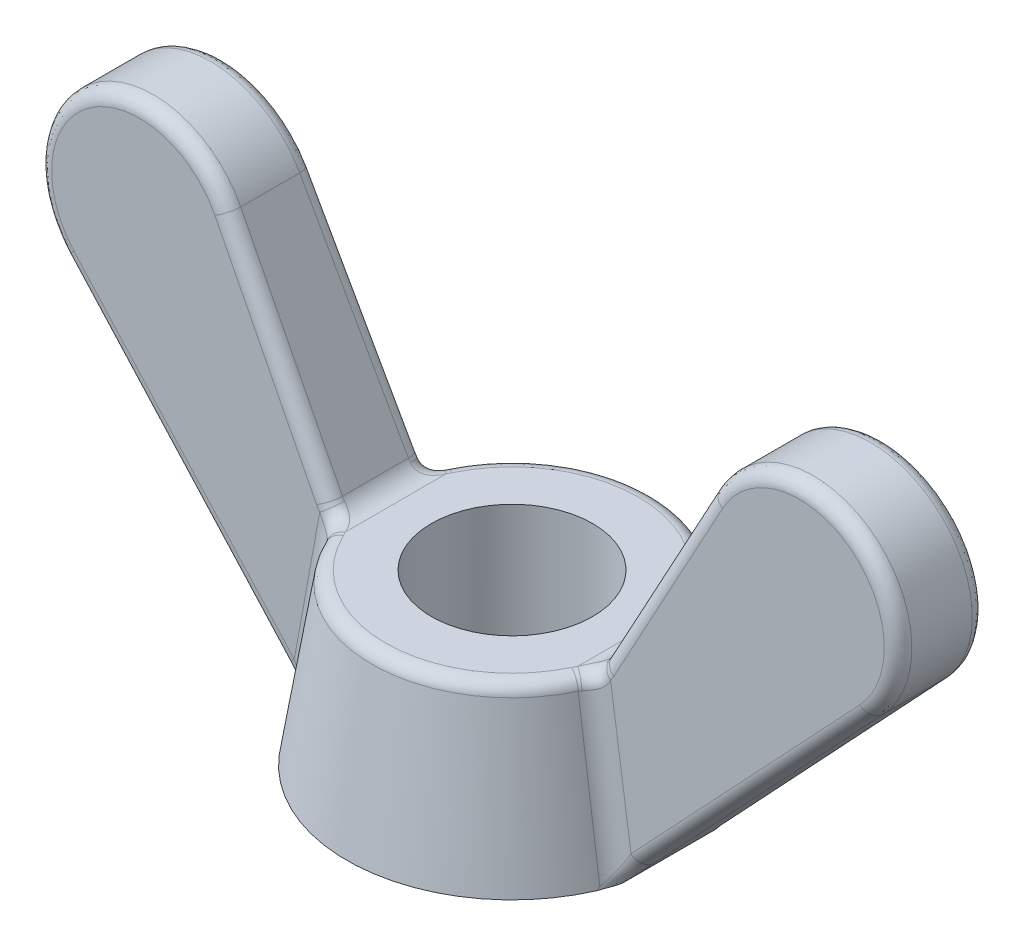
SolidWorks part; units mm, degrees
ref_plane "Front Plane" through (0, 0, 0) normal (0, 0, 1) x (1, 0, 0)
ref_plane "Top Plane" through (0, 0, 0) normal (0, 1, 0) x (1, 0, 0)
ref_plane "Right Plane" through (0, 0, 0) normal (1, 0, 0) x (0, 0, -1)
sketch "BaseNutSke" plane through (0, 0, 0) normal (0, 0, 1) x (1, 0, 0)
  line L0 (0, 0) -> (-21.5, 0)
  line L1 (-21.5, 0) -> (-18, 22)
  line L2 (-18, 22) -> (0, 22)
  line L3 (0, 22) -> (0, 0)
  line L4 (0, -38.5148) -> (0, 38.5148) construction
  dimension "Top_Width" = 36
  dimension "Bottom_Width" = 43
  dimension "Nut_Height" = 22
revolve "BaseNut" add sketch "BaseNutSke" angle 360 about L4
sketch "BaseWingSke" plane through (0, 0, 0) normal (1, 0, 0) x (0, 0, -1)
  line L0 (0, 0) -> (0, 62.8635) construction
  line L1 (-5.5, 56) -> (-6.5, 0)
  line L2 (-5.5, 56) -> (5.5, 56)
  line L3 (5.5, 56) -> (6.5, 0)
  line L4 (6.5, 0) -> (-6.5, 0)
  point P8 (0, 56)
  dimension "TopWing_Width" = 11
  dimension "BottomWing_Width" = 13
  dimension "Height" = 56
extrude "BaseWing" add sketch "BaseWingSke" along normal mid plane 112
sketch "CutWingSke" plane through (0, 0, 0) normal (0, 0, 1) x (1, 0, 0)
  line L0 (0, 0) -> (0, 84.5075) construction
  line L1 (-20.4939, 0) -> (-52.4668, 34.043)
  line L2 (-16.9323, 22) -> (-31.4795, 49.126)
  line L3 (56, 56) -> (-56, 56) construction
  line L4 (-56, 56) -> (-56, 0) construction
  line L5 (-16.9323, 22) -> (16.9323, 22)
  line L6 (-20.4939, 0) -> (20.4939, 0)
  line L7 (20.4939, 0) -> (52.4668, 34.043)
  line L8 (16.9323, 22) -> (31.4795, 49.126)
  line L9 (-20.4939, 0) -> (-56, 0) construction
  line L10 (-66, 66) -> (66, 66)
  line L11 (-66, 66) -> (-66, -10)
  line L12 (-66, -10) -> (66, -10)
  line L13 (66, 66) -> (66, -10)
  line L14 (56, 56) -> (56, 0) construction
  arc A0 (-31.4795, 49.126) -> (-52.4668, 34.043) centre (-42.966, 42.966) ccw
  arc A1 (31.4795, 49.126) -> (52.4668, 34.043) centre (42.966, 42.966) cw
  dimension "D1" = 10
  dimension "Wing_ang" = 15
  dimension "D2" = 10
  dimension "D3" = 10
  dimension "D4" = 10
extrude "CutWing" cut sketch "CutWingSke" against normal mid plane 112
sketch "HoleSke" plane through (0, 0, 0) normal (0, 1, 0) x (1, 0, 0)
  circle A0 centre (0, 0) radius 10.5
  dimension "Tap_drill" = 21
extrude "TappedHole" cut sketch "HoleSke" along normal through all
chamfer "Chamfer1" distance 1.4 angle 60 1 edges at (0, 0, 10.5)
sketch "ThdSchSke" plane through (0, 0, 0) normal (0, 0, 1) x (1, 0, 0)
  line L0 (10.5, 1.4) -> (8.7679, 1.4)
  line L1 (8.7679, 1.4) -> (8.7679, 3.1321)
  line L2 (8.7679, 3.1321) -> (10.5, 3.1321)
  line L3 (10.5, 3.1321) -> (12, 2.266)
  line L4 (12, 2.266) -> (10.5, 1.4)
  line L5 (0, -3.4614) -> (0, 8.4929) construction
  line L6 (-10.5, 1.4) -> (10.5, 1.4) construction
  dimension "D1" = 21
  dimension "ThreadN" = 24
revolve "ThreadSchematic" [suppressed] cut sketch "ThdSchSke" angle 360 about L5
pattern_linear "ThdSchPat" [suppressed]
fillet "Fillet1" radius 3 6 edges at (-16.9323, 22, 0) (16.9323, 22, 0)
fillet "Fillet2" radius 1.8 30 edges at (-21.4266, 0.9931, 6.6579) (-37.3823, 17.9819, 6.1789) (-50.5726, 53.5502, 5.5437) (-24.9759, 36.9987, 5.8393) (-17.1926, 22.8149, 6.5578) (0, 22, -18) (0, 22, 18) (16.7923, 22.498, 6.9107) (24.9759, 36.9987, 5.8393) (21.2732, 0.8298, 6.7311) (37.3823, 17.9819, 6.1789) (21.4266, 0.9931, -6.6579) (37.3823, 17.9819, -6.1789) (50.5726, 53.5502, -5.5437) (-21.2732, 0.8298, -6.7311) (-37.3823, 17.9819, -6.1789) (-50.5726, 53.5502, -5.5437) (-24.9759, 36.9987, -5.8393) (-16.7923, 22.498, -6.9107) (17.1926, 22.8149, -6.5578) (50.5726, 53.5502, 5.5437) (24.9759, 36.9987, -5.8393)
equation "\"D1@CutWing\" = \"Width@BaseWing\""
equation "\"D1@Chamfer1\" = \"Tap_drill@HoleSke\"/15"
equation "\"D1@ThdSchSke\" = \"Tap_drill@HoleSke\""
equation "\"ThreadN@ThdSchSke\" = \"Thread_major@ThreadCosmetic\""
equation "\"Num_threads@ThdSchPat\" = int( \"Nut_Height@BaseNutSke\"/\"Advance@ThdSchPat\" ) +1"
equation "\"D1@Fillet1\" =\"Top_Width@BaseNutSke\"/12"
equation "\"D1@Fillet2\" = \"Top_Width@BaseNutSke\"/20"
